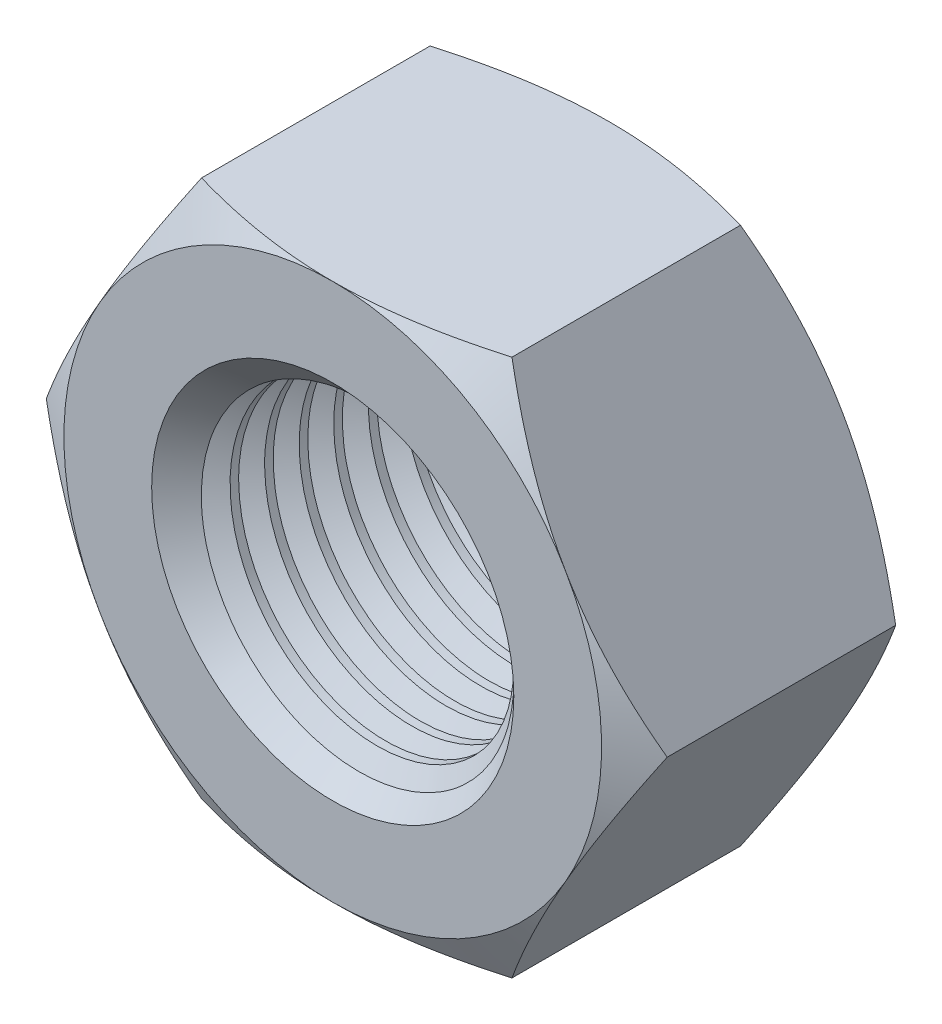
SolidWorks part; units mm, degrees
ref_plane "Front" through (0, 0, 0) normal (0, 0, 1) x (1, 0, 0)
ref_plane "Top" through (0, 0, 0) normal (0, 1, 0) x (1, 0, 0)
ref_plane "Right" through (0, 0, 0) normal (1, 0, 0) x (0, 0, -1)
sketch "Çizim1" plane through (0, 0, 0) normal (0, 0, 1) x (1, 0, 0)
  line L1 (40.4145, 0) -> (20.2073, 35)
  line L2 (20.2073, 35) -> (-20.2073, 35)
  line L3 (-20.2073, 35) -> (-40.4145, 0)
  line L4 (-40.4145, 0) -> (-20.2073, -35)
  line L5 (-20.2073, -35) -> (20.2073, -35)
  line L6 (20.2073, -35) -> (40.4145, 0)
  circle A0 centre (0, 0) radius 35 construction
  point P1 (0, 0)
  dimension "D1" = 70
extrude "Yükseklik-Ekstrüzyon1" add sketch "Çizim1" along normal blind 36
sketch "Çizim2" plane through (0, 0, 36) normal (0, 0, 1) x (1, 0, 0)
  circle A0 centre (0, 0) radius 35
extrude "Kes-Ekstrüzyon1" cut sketch "Çizim2" against normal blind 36 draft 60 flip side to cut
sketch "Çizim3" plane through (0, 0, 0) normal (0, 0, -1) x (-1, 0, 0)
  circle A0 centre (0, 0) radius 35
extrude "Kes-Ekstrüzyon2" cut sketch "Çizim3" against normal blind 36 draft 60 flip side to cut
sketch "Çizim4" plane through (0, 0, 0) normal (0, 0, -1) x (-1, 0, 0)
  circle A0 centre (0, 0) radius 19.575
  dimension "D1" = 39.15
extrude "Kes-Ekstrüzyon3" cut sketch "Çizim4" against normal blind 36
chamfer "Pah1" distance 4 angle 45 2 edges at (-19.575, 0, 36) (-19.575, 0, 0)
sketch "Çizim5" plane through (0, 0, 36) normal (0, 0, 1) x (1, 0, 0)
  circle A0 centre (0, 0) radius 19.575
curve "Helis/Spiral1"
ref_plane "Düzlem1" through (-14.9953, -12.5826, -4) normal (-0.6424, 0.7655, -0.0366) x (0.7664, 0.6416, -0.0306)
sketch "Çizim6" plane through (-14.9953, -12.5826, -4) normal (-0.6424, 0.7655, -0.0366) x (0.7664, 0.6416, -0.0306)
  line L0 (0.9651, 2.2459) -> (0.9651, -2.2459)
  line L1 (-2.925, 0) -> (0.9651, -2.2459)
  line L3 (0.9651, 2.2459) -> (-2.925, 0)
  line L5 (1.4625, 0) -> (1.4625, 2.5331)
  circle A0 centre (0, 0) radius 1.4625 construction
  dimension "D1" = 2.925
sweep "Kes-Süpür1" cut profiles "Çizim6" path "Helis/Spiral1"
